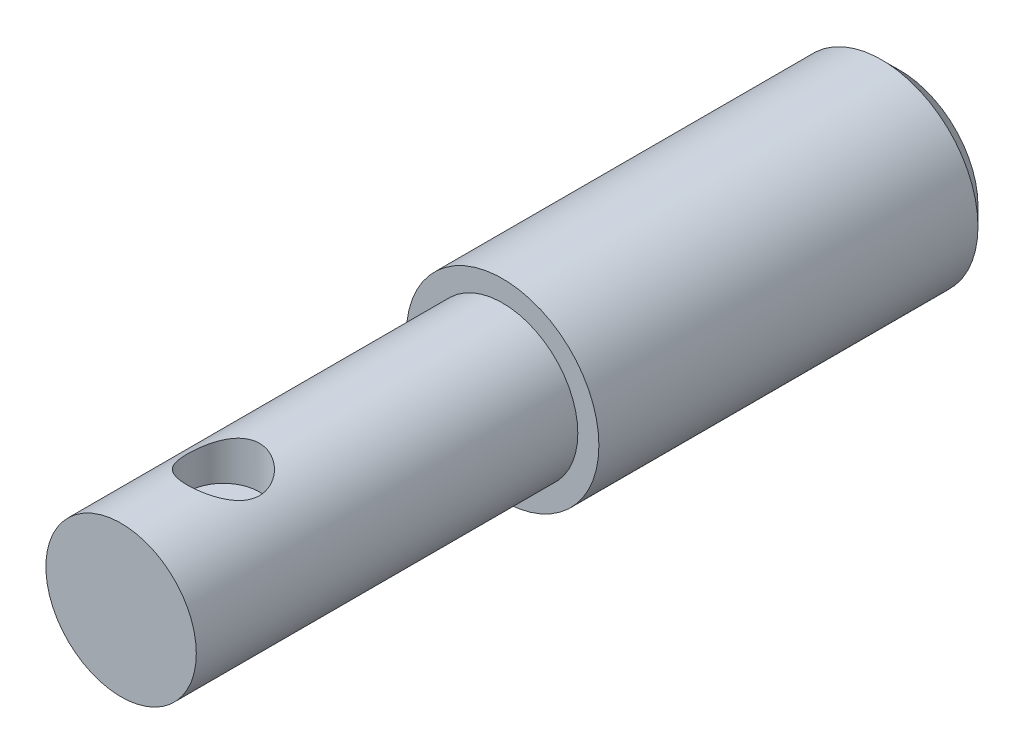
SolidWorks part; units mm, degrees
ref_plane "Front Plane" through (0, 0, 0) normal (0, 0, 1) x (1, 0, 0)
ref_plane "Top Plane" through (0, 0, 0) normal (0, 1, 0) x (1, 0, 0)
ref_plane "Right Plane" through (0, 0, 0) normal (1, 0, 0) x (0, 0, -1)
sketch "Sketch1" plane through (0, 0, 0) normal (0, 0, 1) x (1, 0, 0)
  circle A0 centre (0, 0) radius 4
  dimension "D1" = 8
extrude "Boss-Extrude1" add sketch "Sketch1" along normal blind 16.5
sketch "Sketch2" plane through (0, 0, 16.5) normal (0, 0, 1) x (1, 0, 0)
  circle A0 centre (0, 0) radius 3.125
  dimension "D1" = 6.25
extrude "Boss-Extrude2" add sketch "Sketch2" along normal blind 15.85
chamfer "Chamfer1" distance 0.75 angle 45 1 edges at (4, 0, 0)
ref_plane "Plane1" through (0, 3.125, 0) normal (0, 1, 0) x (1, 0, 0)
hole_wizard "Ø3.0 (3) Diameter Hole2" positions "Sketch7" profile "Sketch6" hole size "Ø3.0" standard "ANSI Metric"
sketch "Sketch7" plane through (0, 3.125, 0) normal (0, 1, 0) x (1, 0, 0)
  point P0 (0, -28.1)
  dimension "D1" = 28.1
sketch "Sketch6" plane through (0, 3.125, 28.1) normal (1, 0, 0) x (0, 0, 1)
  line L0 (0, 0) -> (0, 1.75)
  line L1 (0, 1.75) -> (1.5, 1.75)
  line L2 (1.5, 1.75) -> (1.5, 0)
  line L5 (1.5, 0) -> (0, 0)
  line L10 (0, 1.75) -> (-1.5, 1.75) construction
  line L11 (0, -6.35) -> (0, 107.95) construction
  dimension "Hole Dia." = 3
  dimension "Hole Depth" = 1.75
  dimension "Drill Angle" = 180
